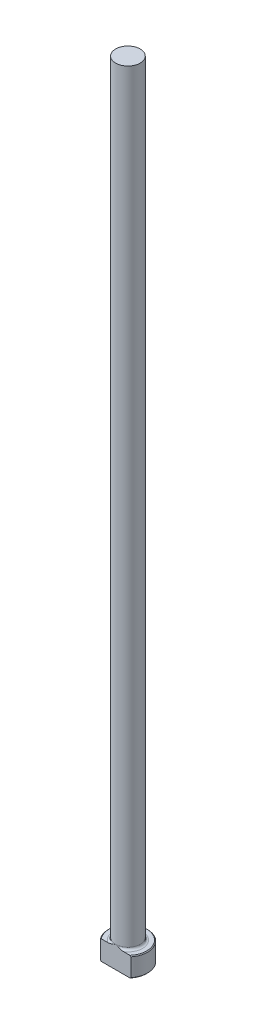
SolidWorks part; units mm, degrees
ref_plane "Front Plane" through (0, 0, 0) normal (0, 0, 1) x (1, 0, 0)
ref_plane "Top Plane" through (0, 0, 0) normal (0, 1, 0) x (1, 0, 0)
ref_plane "Right Plane" through (0, 0, 0) normal (1, 0, 0) x (0, 0, -1)
sketch "Sketch1" plane through (0, 0, 0) normal (0, 0, 1) x (1, 0, 0)
  line L0 (0, 259.9588) -> (0, -15.1925) construction
  line L1 (0, 0) -> (-6.35, 0)
  line L2 (-6.35, 0) -> (-6.35, 6.35)
  line L3 (-6.35, 6.35) -> (-3.9687, 6.35)
  line L4 (-3.9687, 6.35) -> (-3.9687, 254)
  line L5 (-3.9687, 254) -> (0, 254)
  line L6 (0, 254) -> (0, 0)
  dimension "L" = 254
  dimension "H" = 12.7
  dimension "T" = 6.35
  dimension "D" = 7.9375
revolve "Revolve1" add sketch "Sketch1" angle 360 about L0
chamfer "Chamfer1" distance 0.254 angle 45 2 edges at (0, 6.35, 6.35) (0, 0, 6.35)
fillet "Fillet1" radius 0.762 1 edges at (0, 6.35, 3.9687)
sketch "Sketch2" plane through (0, 0, 0) normal (0, 1, 0) x (1, 0, 0)
  line L0 (-4.957, -3.9687) -> (4.957, -3.9687)
  circle A0 centre (0, 0) radius 6.35 construction
  arc A1 (-4.957, -3.9687) -> (4.957, -3.9687) centre (0, 0) ccw
  circle A3 centre (0, 0) radius 3.9687 construction
  dimension "D1" = 0
extrude "Key" cut sketch "Sketch2" along normal through all
sketch "Pocket Sketch" plane through (0, 0, 0) normal (0, 0, 1) x (1, 0, 0)
  line L0 (-6.7469, 0) -> (-6.7469, 6.3754)
  line L1 (-6.7469, 6.3754) -> (-5.1276, 6.3754)
  line L2 (-4.3656, 7.1374) -> (-4.3656, 22.225)
  line L3 (-4.3656, 22.225) -> (0, 22.225)
  line L4 (0, 22.225) -> (0, 0)
  line L5 (0, 0) -> (-6.7469, 0)
  line L6 (0, 12.6104) -> (0, -2.4989) construction
  line L7 (-6.35, 6.096) -> (-6.35, 0.254) construction
  line L8 (6.096, 6.35) -> (-6.096, 6.35) construction
  line L9 (-3.9687, 254) -> (-3.9687, 7.112) construction
  line L10 (-5.1276, 6.3754) -> (-4.3656, 7.1374)
  point P3 (-4.3656, 6.3754)
  dimension "D1" = 13.4937
  dimension "D2" = 0.3969
  dimension "D3" = 0.0254
  dimension "D4" = 0.3969
  dimension "D5" = 8.7312
  dimension "D6" = 22.225
